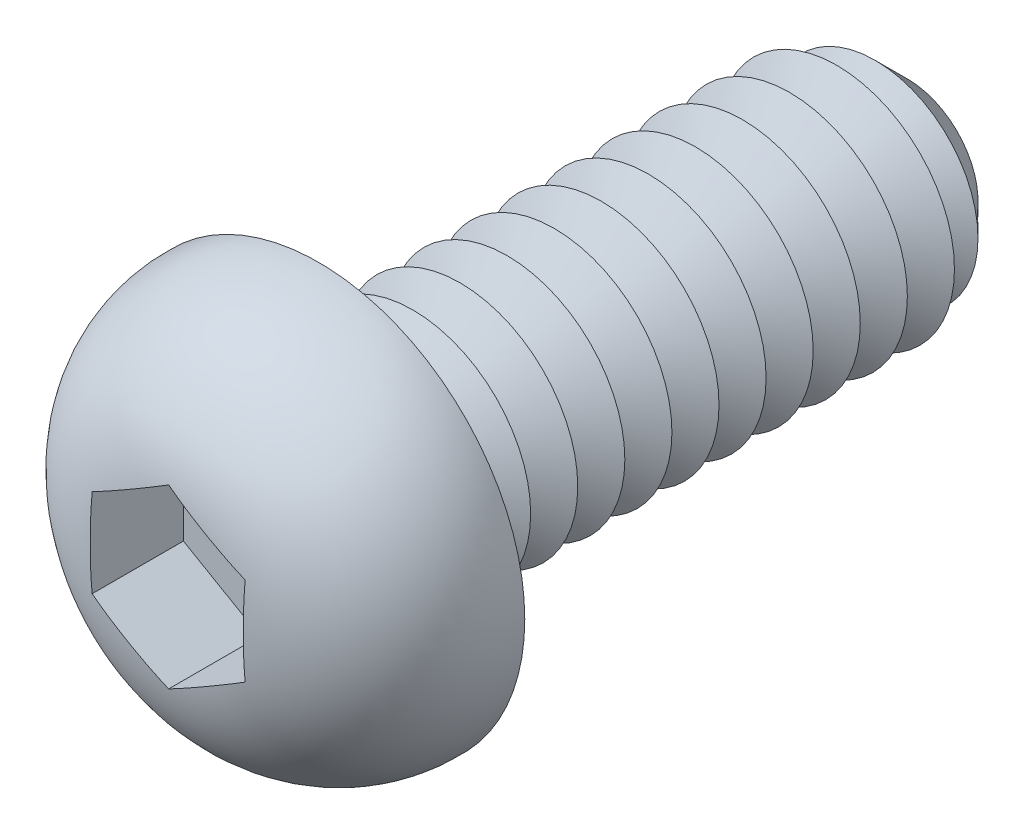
SolidWorks part; units mm, degrees
ref_plane "Front Plane" through (0, 0, 0) normal (0, 0, 1) x (1, 0, 0)
ref_plane "Top Plane" through (0, 0, 0) normal (0, 1, 0) x (1, 0, 0)
ref_plane "Right Plane" through (0, 0, 0) normal (1, 0, 0) x (0, 0, -1)
sketch "Sketch1" plane through (0, 0, 0) normal (1, 0, 0) x (0, 0, -1)
  line L0 (-47.9342, 0) -> (60.3146, 0) construction
sketch "Sketch2" plane through (0, 0, 0) normal (1, 0, 0) x (0, 0, -1)
  line L0 (0, 0) -> (-1.3, 0)
  line L1 (-47.9342, 0) -> (60.3146, 0) construction
  line L2 (-1.3, 0) -> (-1.3, 0.501)
  line L3 (0, 1.75) -> (0, 0)
  arc A0 (-1.3, 0.501) -> (0, 1.75) centre (-0.05, 0.501) cw
  dimension "D1" = 1.25
  dimension "D2" = 1.3
  dimension "D3" = 1.75
revolve "Revolve1" add sketch "Sketch2" angle 360 about L0
sketch "Sketch3" plane through (0, 0, 1.3) normal (0, 0, 1) x (1, 0, 0)
  line L1 (0, 0.7506) -> (-0.65, 0.3753)
  line L2 (-0.65, 0.3753) -> (-0.65, -0.3753)
  line L3 (-0.65, -0.3753) -> (0, -0.7506)
  line L4 (0, -0.7506) -> (0.65, -0.3753)
  line L5 (0.65, -0.3753) -> (0.65, 0.3753)
  line L6 (0.65, 0.3753) -> (0, 0.7506)
  circle A0 centre (0, 0) radius 0.65 construction
  dimension "D1" = 1.3
extrude "Cut-Extrude1" cut sketch "Sketch3" against normal blind 0.8
sketch "Sketch4" plane through (0, 0, 0) normal (0, 0, -1) x (-1, 0, 0)
  circle A0 centre (0, 0) radius 1
  dimension "D1" = 2
extrude "Boss-Extrude1" add sketch "Sketch4" along normal blind 5
chamfer "Chamfer1" distance 0.4 angle 45 1 edges at (-1, 0, -5)
sketch "Sketch5" plane through (0, 0, 0) normal (1, 0, 0) x (0, 0, -1)
  line L0 (0.4, 1) -> (0.8, 1)
  line L1 (4.6, 1) -> (0, 1) construction
  line L2 (0.8, 1) -> (0.6, 0.6536)
  line L3 (0.6, 0.6536) -> (0.4, 1)
  line L4 (0, -1.75) -> (0, 1.75) construction
  line L5 (4.6, 1) -> (0, 1) construction
  dimension "D1" = 0.4
  dimension "D2" = 0.4
revolve "Cut-Revolve1" cut sketch "Sketch5" angle 360 about L0
pattern_linear "LPattern1" count 11 spacing 0.4 along (0, 0, -1) of "Cut-Revolve1"
fillet "Fillet2" radius 0.2 1 edges at (-1, 0, 0)
sketch "Sketch6" plane through (0, 0, 0.5) normal (0, 0, 1) x (1, 0, 0)
  circle A0 centre (0, 0) radius 0.35
  dimension "D1" = 0.7
extrude "Cut-Extrude2" cut sketch "Sketch6" against normal up to surface (5.5 mm away)
